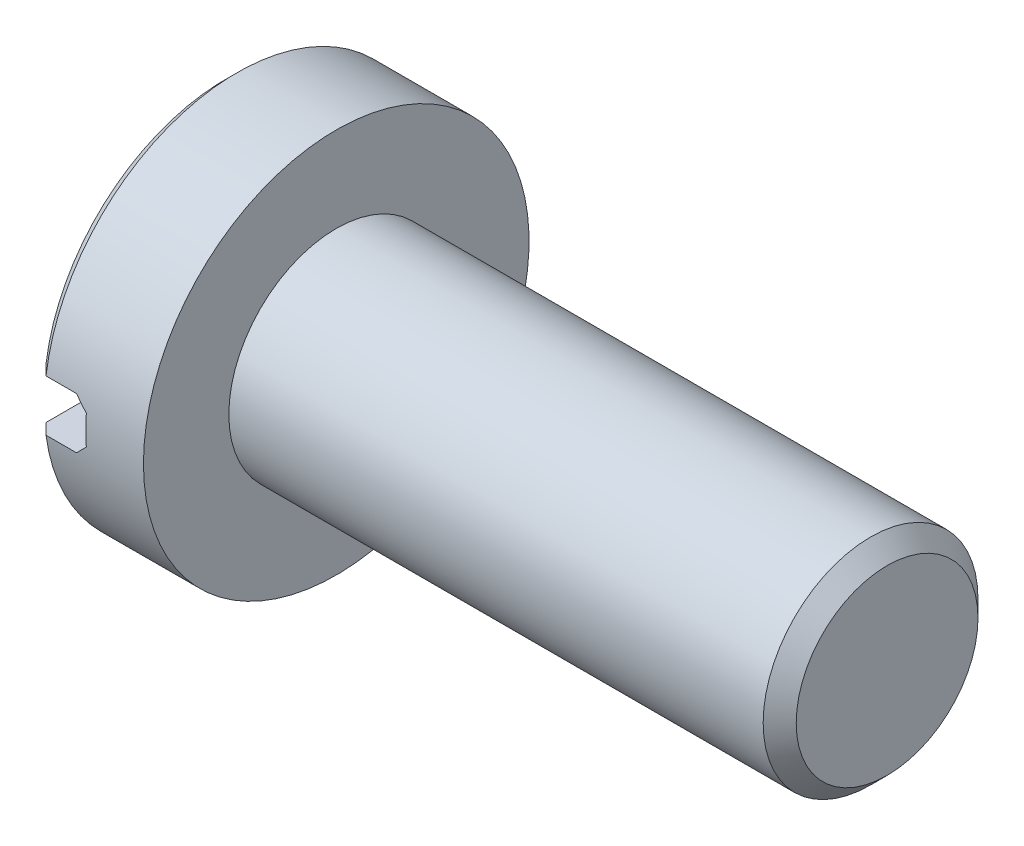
SolidWorks part; units mm, degrees
ref_plane "Face" through (0, 0, 0) normal (0, 0, 1) x (1, 0, 0)
ref_plane "Dessus" through (0, 0, 0) normal (0, 1, 0) x (1, 0, 0)
ref_plane "Droite" through (0, 0, 0) normal (1, 0, 0) x (0, 0, -1)
sketch "Esquisse1" plane through (0, 0, 0) normal (0, 0, 1) x (1, 0, 0)
  line L0 (0, 0) -> (0, 3.3)
  line L1 (0.2, 3.5) -> (2, 3.5)
  line L2 (2, 3.5) -> (2, 0)
  line L5 (0, 0) -> (7.6423, 0) construction
  line L7 (0, 3.3) -> (0.2, 3.5)
  line L8 (0, 0) -> (2, 0)
  point P1 (0, 3.5)
  dimension "D1" = 3.5
  dimension "D3" = 2
revolve "Révolution1" add sketch "Esquisse1" angle 360 about L5
sketch "Esquisse2" plane through (0, 0, 0) normal (0, 0, 1) x (1, 0, 0)
  line L0 (0, 3.3) -> (0, -3.3) construction
  line L1 (0, 0.4655) -> (0.7534, 0.4655)
  line L2 (0, 0.4655) -> (0, -0.4655)
  line L3 (0, -0.4655) -> (0.7534, -0.4655)
  line L4 (0.9534, 0.2655) -> (0.9534, -0.2655)
  line L5 (0.7534, 0.4655) -> (0.9534, 0.2655)
  line L6 (0.7534, -0.4655) -> (0.9534, -0.2655)
  point P1 (0.9534, -0.4655)
  point P3 (0.9534, 0.4655)
extrude "Enlèv. mat.-Extru.1" cut sketch "Esquisse2" against normal mid plane 10
sketch "Esquisse3" plane through (2, 0, 0) normal (1, 0, 0) x (0, 0, -1)
  circle A0 centre (0, 0) radius 1.95
  dimension "D1" = 3.9
extrude "Extrusion1" add sketch "Esquisse3" along normal blind 10
chamfer "Chanfrein1" distance 0.3 angle 45 1 edges at (12, 0, -1.95)
